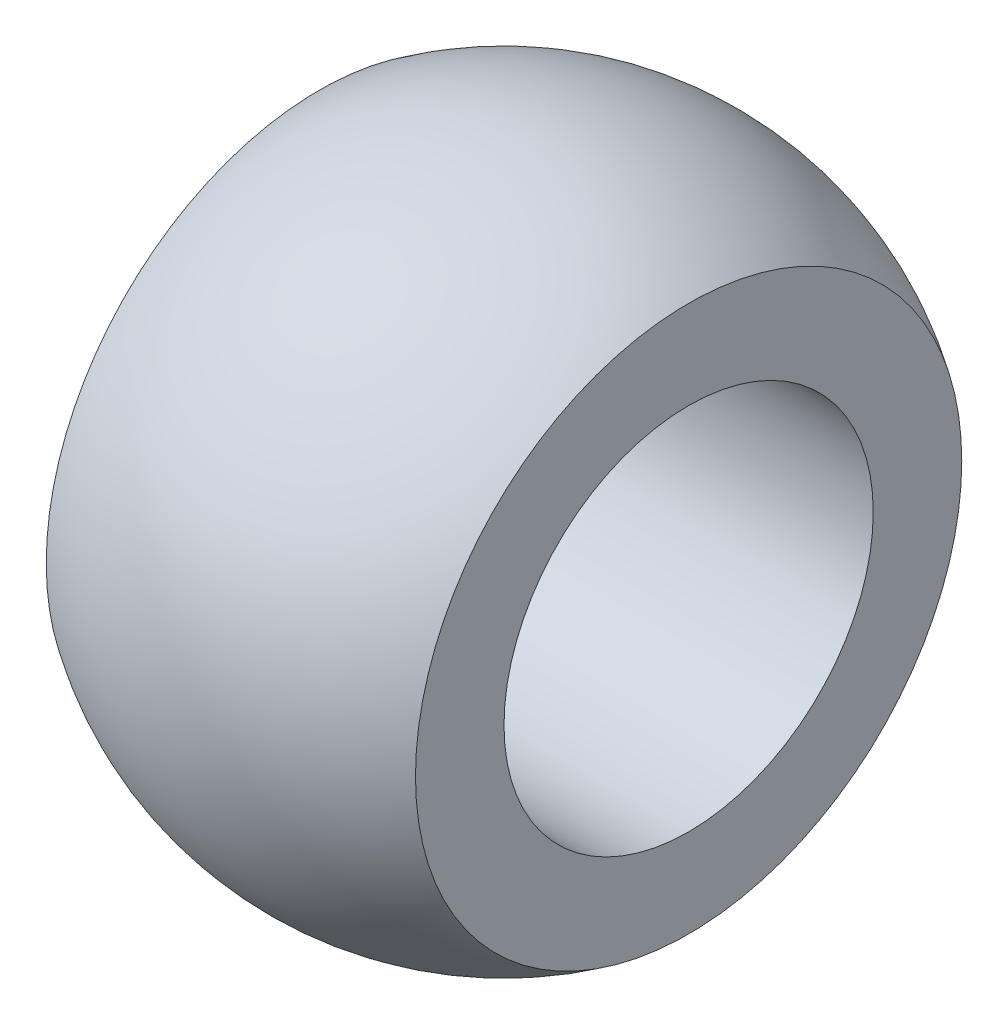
SolidWorks part; units mm, degrees
ref_plane "Plane1" through (0, 0, 0) normal (0, 0, 1) x (1, 0, 0)
ref_plane "Plane2" through (0, 0, 0) normal (0, 1, 0) x (1, 0, 0)
ref_plane "Plane3" through (0, 0, 0) normal (1, 0, 0) x (0, 0, -1)
sketch "Esquisse2" plane through (0, 0, 0) normal (0, 0, 1) x (1, 0, 0)
  line L1 (-20, 0) -> (20, 0) construction
  line L2 (-7, 10.3562) -> (-7, 7)
  line L3 (-7, 7) -> (7, 7)
  line L4 (7, 10.3562) -> (7, 7)
  arc A1 (7, 10.3562) -> (-7, 10.3562) centre (0, 0) ccw
  point P13 (0, 7)
  dimension "D1" = 12.5
  dimension "D2" = 14
  dimension "D3" = 7
revolve "Base-Révolution" add sketch "Esquisse2" angle 360 about L1
